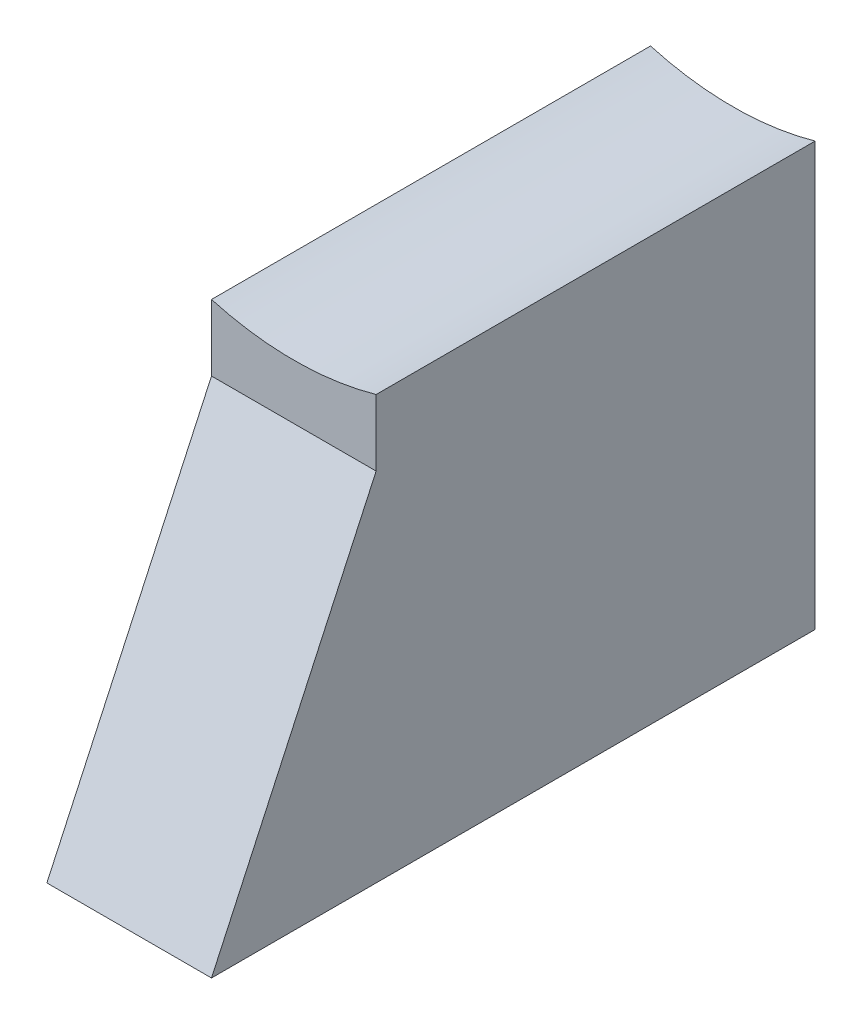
SolidWorks part; units mm, degrees
ref_plane "前视基准面" through (0, 0, 0) normal (0, 0, 1) x (1, 0, 0)
ref_plane "上视基准面" through (0, 0, 0) normal (0, 1, 0) x (1, 0, 0)
ref_plane "右视基准面" through (0, 0, 0) normal (1, 0, 0) x (0, 0, -1)
sketch "草图1" plane through (0, 0, 0) normal (0, 1, 0) x (1, 0, 0)
  line L0 (30, 0) -> (-30, 0)
  line L1 (-30, 0) -> (-30, -16)
  line L2 (-24, -22) -> (24, -22)
  line L3 (0, 24.4123) -> (0, -40.1298) construction
  line L4 (-24, -8.8168) -> (-24, -27.5731) construction
  line L5 (-35.1279, -16) -> (-17.5773, -16) construction
  line L6 (30, 0) -> (30, -16)
  circle A0 centre (-24, -16) radius 3
  arc A1 (-30, -16) -> (-24, -22) centre (-24, -16) ccw
  circle A2 centre (24, -16) radius 3
  arc A3 (30, -16) -> (24, -22) centre (24, -16) cw
  point P15 (-30, -22)
  point P20 (0, -22)
  point P21 (0, 0)
  dimension "D3" = 6
  dimension "D4" = 6
  dimension "D1" = 30
  dimension "D2" = 22
extrude "凸台-拉伸1" add sketch "草图1" along normal blind 6
sketch "草图2" plane through (0, 0, 22) normal (0, 0, 1) x (1, 0, 0)
  line L0 (16, 0) -> (-16, 0)
  line L1 (-24, 0) -> (24, 0) construction
  line L2 (-16, 0) -> (-16, 2)
  line L3 (-16, 2) -> (16, 2)
  line L4 (0, -3.784) -> (0, 11.3172) construction
  line L5 (16, 0) -> (16, 2)
  point P7 (0, 0)
  point P11 (0, 2)
  dimension "D1" = 16
  dimension "D2" = 2
extrude "切除-拉伸1" cut sketch "草图2" against normal through all
ref_plane "基准面1" through (0, 0, -6) normal (0, 0, 1) x (1, 0, 0)
ref_plane "基准面2" through (0, 0, 18) normal (0, 0, 1) x (1, 0, 0)
sketch "草图3" plane through (0, 0, -6) normal (0, 0, 1) x (1, 0, 0)
  line L0 (0, -4.0413) -> (0, 64.9005) construction
  line L1 (-27.9551, 32) -> (38.6747, 32) construction
  circle A0 centre (0, 32) radius 7
  circle A1 centre (0, 32) radius 11
  dimension "D2" = 22
  dimension "D3" = 14
  dimension "D1" = 32
extrude "凸台-拉伸2" add sketch "草图3" along normal blind 24 separate body
sketch "草图4" plane through (0, 0, 0) normal (0, 0, 1) x (1, 0, 0)
  line L0 (0, 53.8311) -> (0, -10.6851) construction
  line L1 (-10.3554, 35.7101) -> (-21, 6)
  line L2 (-24, 6) -> (24, 6) construction
  line L3 (-21, 6) -> (21, 6)
  line L4 (10.3554, 35.7101) -> (21, 6)
  arc A0 (-10.3554, 35.7101) -> (10.3554, 35.7101) centre (0, 32) ccw
  point P12 (0, 6)
  dimension "D1" = 22
  dimension "D2" = 21
extrude "凸台-拉伸3" add sketch "草图4" along normal blind 6
sketch "草图5" plane through (0, 0, 0) normal (1, 0, 0) x (0, 0, -1)
  line L0 (-16, 22.837) -> (-6, 22.837)
  line L1 (-6, 35.7101) -> (-6, 21) construction
  line L2 (-6, 22.837) -> (-6, 6)
  line L3 (-6, 6) -> (-6, 35.7101) construction
  line L4 (-6, 6) -> (-22, 6)
  line L5 (-22, 6) -> (-16, 19)
  line L6 (-16, 19) -> (-16, 22.837)
  dimension "D1" = 10
  dimension "D2" = 13
extrude "凸台-拉伸4" add sketch "草图5" along normal mid plane 6
sketch "草图6" plane through (0, 0, 0) normal (0, 0, 1) x (1, 0, 0)
  line L0 (-3, 21.417) -> (-3, 6)
  line L1 (-3, 6) -> (3, 6)
  line L2 (3, 6) -> (3, 21.417)
  arc A0 (-3, 21.417) -> (3, 21.417) centre (0, 32) ccw
extrude "切除-拉伸2" cut sketch "草图6" against normal mid plane 56 flip side to cut
